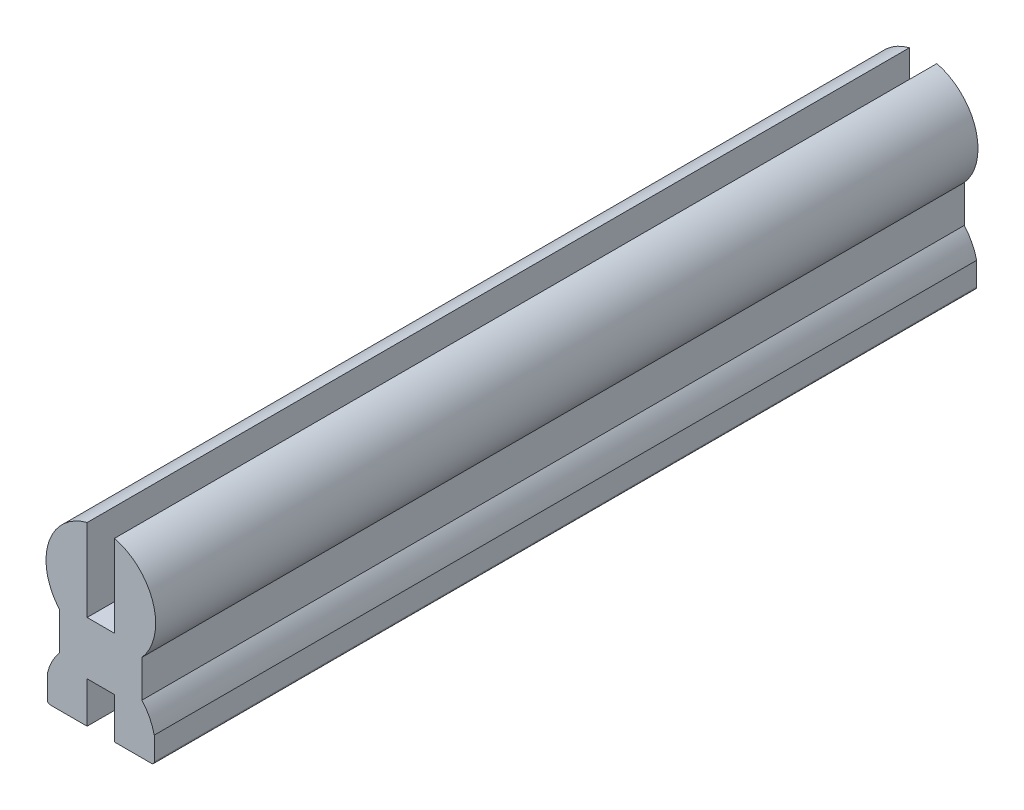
SolidWorks part; units mm, degrees
ref_plane "前视基准面" through (0, 0, 0) normal (0, 0, 1) x (1, 0, 0)
ref_plane "上视基准面" through (0, 0, 0) normal (0, 1, 0) x (1, 0, 0)
ref_plane "右视基准面" through (0, 0, 0) normal (1, 0, 0) x (0, 0, -1)
sketch "草图1" plane through (0, 0, 0) normal (0, 0, 1) x (1, 0, 0)
  line L0 (-1.95, -2.5) -> (-0.5, -2.5)
  line L1 (-0.5, 3.9365) -> (-0.5, 0.9365)
  line L2 (-1.5, 0.6771) -> (-1.5, -0.6771)
  line L3 (0.5, 0.9365) -> (0.5, 3.9365)
  line L4 (1.5, 0.6771) -> (1.5, -0.6771)
  line L5 (-1.95, -2.5) -> (-1.95, -1.5556)
  line L6 (1.95, -2.5) -> (1.95, -1.5556)
  line L7 (-0.5, -1) -> (0.5, -1)
  line L9 (-0.5, -1) -> (-0.5, -2.5)
  line L10 (0.5, -1) -> (0.5, -2.5)
  line L11 (0.5, -2.5) -> (1.95, -2.5)
  line L13 (-0.5, 0.9365) -> (0.5, 0.9365)
  arc A0 (1.95, -1.5556) -> (1.5, -0.6771) centre (0, -2) ccw
  arc A1 (-1.5, -0.6771) -> (-1.95, -1.5556) centre (0, -2) ccw
  arc A2 (1.5, 0.6771) -> (0.5, 3.9365) centre (0, 2) ccw
  arc A3 (-0.5, 3.9365) -> (-1.5, 0.6771) centre (0, 2) ccw
extrude "凸台-拉伸1" add sketch "草图1" against normal blind 30
fillet "圆角1" radius 0.1 2 edges at (-1.95, -2.5, -15) (1.95, -2.5, -15)
